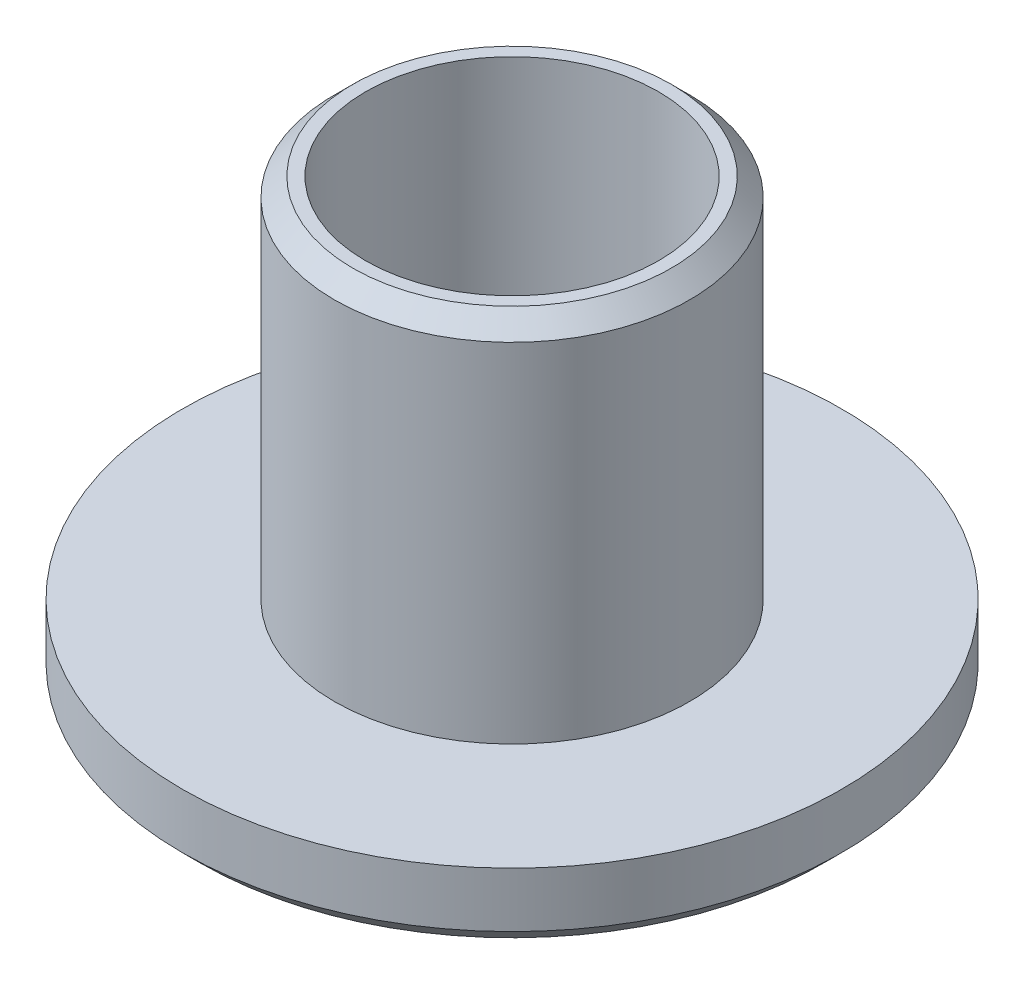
SolidWorks part; units mm, degrees
ref_plane "Ebene vorne" through (0, 0, 0) normal (0, 0, 1) x (1, 0, 0)
ref_plane "Ebene oben" through (0, 0, 0) normal (0, 1, 0) x (1, 0, 0)
ref_plane "Ebene rechts" through (0, 0, 0) normal (1, 0, 0) x (0, 0, -1)
sketch "Skizze1" plane through (0, 0, 0) normal (0, 1, 0) x (1, 0, 0)
  circle A0 centre (0, 0) radius 9
  circle A1 centre (0, 0) radius 4
  dimension "D1" = 18
  dimension "D2" = 8
extrude "Aufsatz-Linear austragen1" add sketch "Skizze1" along normal blind 2
sketch "Skizze2" plane through (0, 2, 0) normal (0, 1, 0) x (1, 0, 0)
  circle A0 centre (0, 0) radius 4 construction
  circle A1 centre (0, 0) radius 4
  circle A2 centre (0, 0) radius 4.85
  dimension "D1" = 9.7
extrude "Aufsatz-Linear austragen2" add sketch "Skizze2" along normal blind 10
chamfer "Fase1" distance 0.5 angle 45 2 edges at (0, 0, 9) (0, 12, 4.85)
